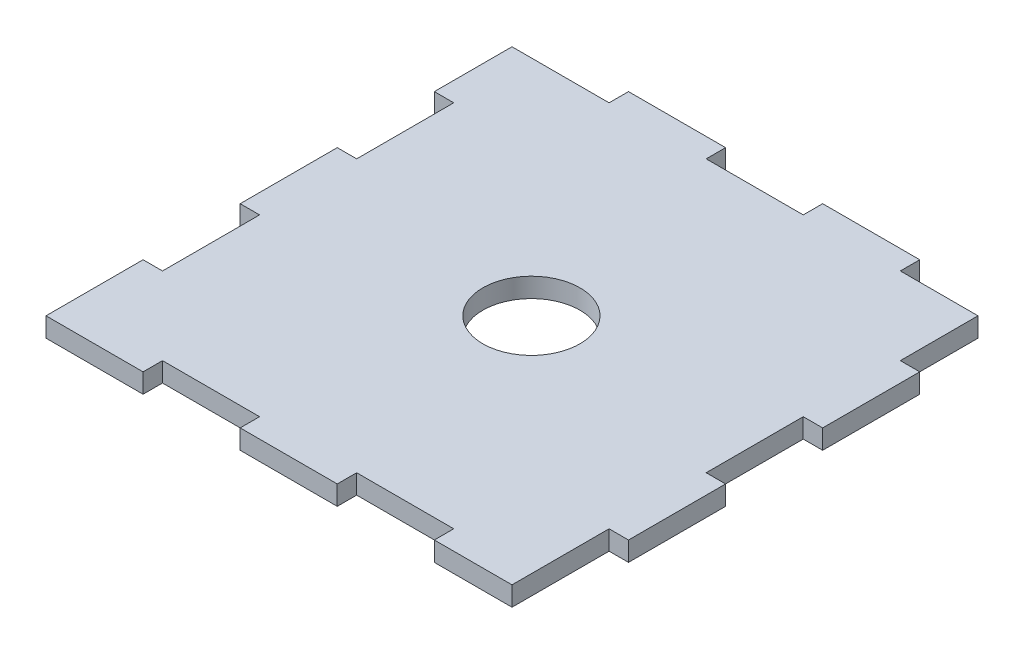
SolidWorks part; units mm, degrees
ref_plane "Front Plane" through (0, 0, 0) normal (0, 0, 1) x (1, 0, 0)
ref_plane "Top Plane" through (0, 0, 0) normal (0, 1, 0) x (1, 0, 0)
ref_plane "Right Plane" through (0, 0, 0) normal (1, 0, 0) x (0, 0, -1)
sketch "Sketch2" plane through (0, 0, 0) normal (0, 1, 0) x (1, 0, 0)
  line L1 (-50, 46) -> (-30, 46)
  line L2 (-50, 46) -> (-50, 30)
  line L3 (-50, -50) -> (-30, -50)
  line L4 (46, 46) -> (46, 30)
  line L8 (-30, 46) -> (-30, 50)
  line L9 (-30, 50) -> (-10, 50)
  line L11 (46, 30) -> (50, 30)
  line L14 (-10, 50) -> (-10, 46)
  line L15 (-10, 46) -> (10, 46)
  line L16 (10, 46) -> (10, 50)
  line L17 (10, 50) -> (30, 50)
  line L18 (30, 50) -> (30, 46)
  line L19 (30, 46) -> (46, 46)
  line L20 (-10, -46) -> (-30, -46)
  line L22 (-10, -46) -> (-10, -50)
  line L23 (-10, -50) -> (10, -50)
  line L24 (10, -50) -> (10, -46)
  line L25 (10, -46) -> (30, -46)
  line L26 (30, -46) -> (30, -50)
  line L27 (30, -50) -> (46, -50)
  line L29 (50, 30) -> (50, 10)
  line L30 (50, 10) -> (46, 10)
  line L31 (46, 10) -> (46, -10)
  line L32 (46, -10) -> (50, -10)
  line L33 (50, -10) -> (50, -30)
  line L34 (50, -30) -> (46, -30)
  line L35 (46, -30) -> (46, -50)
  line L36 (-50, 30) -> (-46, 30)
  line L37 (-46, 30) -> (-46, 10)
  line L38 (-46, 10) -> (-50, 10)
  line L39 (-50, 10) -> (-50, -10)
  line L40 (-50, -10) -> (-46, -10)
  line L41 (-46, -10) -> (-46, -30)
  line L42 (-46, -30) -> (-50, -30)
  line L43 (-50, -30) -> (-50, -50)
  line L44 (-30, -46) -> (-30, -50)
  circle A0 centre (0, 0) radius 10
  point P0 (0, 0)
  point P6 (-150.0415, 26.7079)
extrude "Boss-Extrude1" add sketch "Sketch2" along normal blind 4
equation "\"Slit thick\"= 4"
equation "\"Slit wide\"= 20"
equation "\"Piece Thick\"= 4"
equation "\"Slit distance\"= 20"
equation "\"D3@Sketch2\"=\"Slit distance\""
equation "\"D4@Sketch2\"=\"Slit distance\""
equation "\"D8@Sketch2\"=\"Slit wide\""
equation "\"D10@Sketch2\"=\"Slit wide\""
equation "\"D12@Sketch2\"=\"Slit thick\""
equation "\"D14@Sketch2\"=\"Slit thick\""
equation "\"D16@Sketch2\"=\"Slit distance\""
equation "\"D18@Sketch2\"=\"Slit distance\""
equation "\"D20@Sketch2\"=\"Slit thick\""
equation "\"D22@Sketch2\"=\"Slit distance\""
equation "\"D24@Sketch2\"=\"Slit distance\""
equation "\"diam\"= 20"
equation "\"D25@Sketch2\"=\"diam\""
equation "\"D1@Boss-Extrude1\"=\"Piece Thick\""
equation "\"D26@Sketch2\"=\"Slit thick\""
